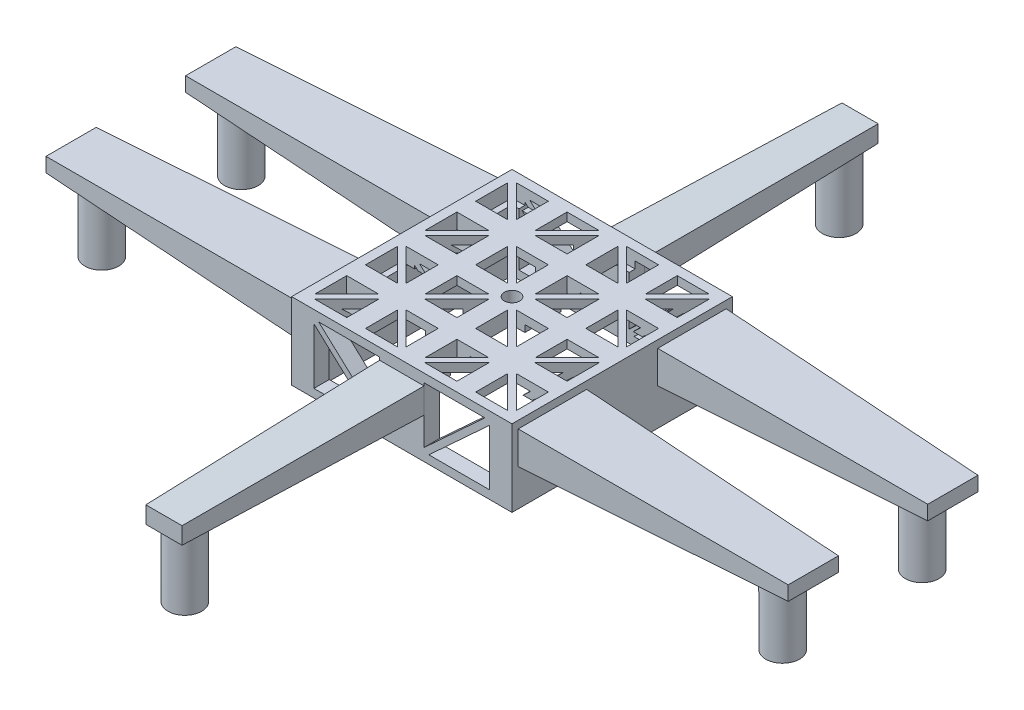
SolidWorks part; units mm, degrees
ref_plane "Front Plane" through (0, 0, 0) normal (0, 0, 1) x (1, 0, 0)
ref_plane "Top Plane" through (0, 0, 0) normal (0, 1, 0) x (1, 0, 0)
ref_plane "Right Plane" through (0, 0, 0) normal (1, 0, 0) x (0, 0, -1)
sketch "Sketch1" plane through (0, 0, 0) normal (0, 1, 0) x (1, 0, 0)
  line L1 (71.7881, -71.7881) -> (-71.7881, -71.7881)
  line L2 (71.7881, -71.7881) -> (71.7881, 71.7881)
  line L3 (71.7881, 71.7881) -> (-71.7881, 71.7881)
  line L4 (-71.7881, -71.7881) -> (-71.7881, 71.7881)
  line L5 (71.7881, -71.7881) -> (-71.7881, 71.7881) construction
  line L6 (71.7881, 71.7881) -> (-71.7881, -71.7881) construction
  point P0 (0, 0)
extrude "Boss-Extrude1" add sketch "Sketch1" along normal blind 50
sketch "Sketch2" plane through (0, 50, 0) normal (0, 1, 0) x (1, 0, 0)
  line L0 (-71.7881, 67.6803) -> (-67.6803, 67.6803) construction
  line L1 (-40.0018, 40.0018) -> (-67.6803, 40.0018) construction
  line L2 (-40.0018, 40.0018) -> (-40.0018, 67.6803) construction
  line L3 (0, 71.7881) -> (0, 0) construction
  line L4 (71.7881, 71.7881) -> (-71.7881, 71.7881) construction
  line L5 (-42.0018, 44.8303) -> (-62.8519, 65.6803)
  line L6 (-71.7881, 0) -> (71.7881, 0) construction
  line L7 (-71.7881, 71.7881) -> (-71.7881, -71.7881) construction
  line L8 (71.7881, -71.7881) -> (71.7881, 71.7881) construction
  line L9 (0, 35.894) -> (-71.7881, 35.894) construction
  line L10 (-35.894, 35.894) -> (-35.894, 71.7881) construction
  line L11 (-40.0018, 67.6803) -> (-67.6803, 67.6803) construction
  line L12 (-67.6803, 40.0018) -> (-67.6803, 67.6803) construction
  line L13 (-40.0018, 40.0018) -> (-67.6803, 67.6803) construction
  line L14 (-40.0018, 67.6803) -> (-67.6803, 40.0018) construction
  line L15 (-40.0018, 67.6803) -> (-35.894, 67.6803) construction
  line L16 (-42.0018, 65.6803) -> (-62.8519, 65.6803)
  line L17 (-42.0018, 44.8303) -> (-42.0018, 65.6803)
  line L18 (-65.6803, 42.0018) -> (-65.6803, 62.8519)
  line L19 (-44.8303, 42.0018) -> (-65.6803, 42.0018)
  line L20 (-44.8303, 42.0018) -> (-65.6803, 62.8519)
  line L21 (-29.7863, 44.8303) -> (-29.7863, 65.6803)
  line L22 (-29.7863, 65.6803) -> (-8.9362, 65.6803)
  line L23 (-29.7863, 44.8303) -> (-8.9362, 65.6803)
  line L24 (-26.9578, 42.0018) -> (-6.1078, 42.0018)
  line L25 (-6.1078, 42.0018) -> (-6.1078, 62.8519)
  line L26 (-26.9578, 42.0018) -> (-6.1078, 62.8519)
  line L27 (-26.9578, 29.7863) -> (-6.1078, 8.9362)
  line L28 (-6.1078, 29.7863) -> (-6.1078, 8.9362)
  line L29 (-26.9578, 29.7863) -> (-6.1078, 29.7863)
  line L30 (-29.7863, 26.9578) -> (-8.9362, 6.1078)
  line L31 (-29.7863, 6.1078) -> (-8.9362, 6.1078)
  line L32 (-29.7863, 26.9578) -> (-29.7863, 6.1078)
  line L33 (-42.0018, 26.9578) -> (-42.0018, 6.1078)
  line L34 (-42.0018, 6.1078) -> (-62.8519, 6.1078)
  line L35 (-42.0018, 26.9578) -> (-62.8519, 6.1078)
  line L36 (-65.6803, 29.7863) -> (-65.6803, 8.9362)
  line L37 (-44.8303, 29.7863) -> (-65.6803, 8.9362)
  line L38 (-44.8303, 29.7863) -> (-65.6803, 29.7863)
  line L39 (42.0018, 44.8303) -> (42.0018, 65.6803)
  line L40 (42.0018, 65.6803) -> (62.8519, 65.6803)
  line L41 (42.0018, 44.8303) -> (62.8519, 65.6803)
  line L42 (44.8303, 42.0018) -> (65.6803, 62.8519)
  line L43 (65.6803, 42.0018) -> (65.6803, 62.8519)
  line L44 (44.8303, 42.0018) -> (65.6803, 42.0018)
  line L45 (26.9578, 42.0018) -> (6.1078, 62.8519)
  line L46 (6.1078, 42.0018) -> (6.1078, 62.8519)
  line L47 (26.9578, 42.0018) -> (6.1078, 42.0018)
  line L48 (29.7863, 44.8303) -> (8.9362, 65.6803)
  line L49 (29.7863, 65.6803) -> (8.9362, 65.6803)
  line L50 (29.7863, 44.8303) -> (29.7863, 65.6803)
  line L51 (44.8303, 29.7863) -> (65.6803, 29.7863)
  line L52 (44.8303, 29.7863) -> (65.6803, 8.9362)
  line L53 (65.6803, 29.7863) -> (65.6803, 8.9362)
  line L54 (42.0018, 26.9578) -> (62.8519, 6.1078)
  line L55 (42.0018, 6.1078) -> (62.8519, 6.1078)
  line L56 (42.0018, 26.9578) -> (42.0018, 6.1078)
  line L57 (29.7863, 26.9578) -> (29.7863, 6.1078)
  line L58 (29.7863, 6.1078) -> (8.9362, 6.1078)
  line L59 (29.7863, 26.9578) -> (8.9362, 6.1078)
  line L60 (26.9578, 29.7863) -> (6.1078, 29.7863)
  line L61 (6.1078, 29.7863) -> (6.1078, 8.9362)
  line L62 (26.9578, 29.7863) -> (6.1078, 8.9362)
  line L63 (-40.0018, -67.6803) -> (-35.894, -67.6803) construction
  line L64 (-40.0018, -67.6803) -> (-67.6803, -40.0018) construction
  line L65 (-40.0018, -40.0018) -> (-67.6803, -67.6803) construction
  line L66 (-67.6803, -40.0018) -> (-67.6803, -67.6803) construction
  line L67 (-40.0018, -67.6803) -> (-67.6803, -67.6803) construction
  line L68 (-40.0018, -40.0018) -> (-40.0018, -67.6803) construction
  line L69 (-40.0018, -40.0018) -> (-67.6803, -40.0018) construction
  line L70 (-71.7881, -67.6803) -> (-67.6803, -67.6803) construction
  line L71 (-44.8303, -42.0018) -> (-65.6803, -62.8519)
  line L72 (-44.8303, -42.0018) -> (-65.6803, -42.0018)
  line L73 (-65.6803, -42.0018) -> (-65.6803, -62.8519)
  line L74 (-42.0018, -44.8303) -> (-42.0018, -65.6803)
  line L75 (-42.0018, -65.6803) -> (-62.8519, -65.6803)
  line L76 (-42.0018, -44.8303) -> (-62.8519, -65.6803)
  line L77 (-26.9578, -42.0018) -> (-6.1078, -62.8519)
  line L78 (-6.1078, -42.0018) -> (-6.1078, -62.8519)
  line L79 (-26.9578, -42.0018) -> (-6.1078, -42.0018)
  line L80 (-29.7863, -44.8303) -> (-8.9362, -65.6803)
  line L81 (-29.7863, -65.6803) -> (-8.9362, -65.6803)
  line L82 (-29.7863, -44.8303) -> (-29.7863, -65.6803)
  line L83 (-44.8303, -29.7863) -> (-65.6803, -29.7863)
  line L84 (-44.8303, -29.7863) -> (-65.6803, -8.9362)
  line L85 (-65.6803, -29.7863) -> (-65.6803, -8.9362)
  line L86 (-42.0018, -26.9578) -> (-62.8519, -6.1078)
  line L87 (-42.0018, -6.1078) -> (-62.8519, -6.1078)
  line L88 (-42.0018, -26.9578) -> (-42.0018, -6.1078)
  line L89 (-29.7863, -26.9578) -> (-29.7863, -6.1078)
  line L90 (-29.7863, -6.1078) -> (-8.9362, -6.1078)
  line L91 (-29.7863, -26.9578) -> (-8.9362, -6.1078)
  line L92 (-26.9578, -29.7863) -> (-6.1078, -29.7863)
  line L93 (-6.1078, -29.7863) -> (-6.1078, -8.9362)
  line L94 (-26.9578, -29.7863) -> (-6.1078, -8.9362)
  line L95 (26.9578, -29.7863) -> (6.1078, -8.9362)
  line L96 (6.1078, -29.7863) -> (6.1078, -8.9362)
  line L97 (26.9578, -29.7863) -> (6.1078, -29.7863)
  line L98 (29.7863, -26.9578) -> (8.9362, -6.1078)
  line L99 (29.7863, -6.1078) -> (8.9362, -6.1078)
  line L100 (29.7863, -26.9578) -> (29.7863, -6.1078)
  line L101 (42.0018, -26.9578) -> (42.0018, -6.1078)
  line L102 (42.0018, -6.1078) -> (62.8519, -6.1078)
  line L103 (42.0018, -26.9578) -> (62.8519, -6.1078)
  line L104 (65.6803, -29.7863) -> (65.6803, -8.9362)
  line L105 (44.8303, -29.7863) -> (65.6803, -8.9362)
  line L106 (44.8303, -29.7863) -> (65.6803, -29.7863)
  line L107 (29.7863, -44.8303) -> (29.7863, -65.6803)
  line L108 (29.7863, -65.6803) -> (8.9362, -65.6803)
  line L109 (29.7863, -44.8303) -> (8.9362, -65.6803)
  line L110 (26.9578, -42.0018) -> (6.1078, -42.0018)
  line L111 (6.1078, -42.0018) -> (6.1078, -62.8519)
  line L112 (26.9578, -42.0018) -> (6.1078, -62.8519)
  line L113 (44.8303, -42.0018) -> (65.6803, -42.0018)
  line L114 (65.6803, -42.0018) -> (65.6803, -62.8519)
  line L115 (44.8303, -42.0018) -> (65.6803, -62.8519)
  line L116 (42.0018, -44.8303) -> (62.8519, -65.6803)
  line L117 (42.0018, -65.6803) -> (62.8519, -65.6803)
  line L118 (42.0018, -44.8303) -> (42.0018, -65.6803)
  point P0 (-53.8411, 53.8411)
  point P20 (-35.894, 53.8411)
  point P79 (-53.8411, -53.8411)
  dimension "D1" = 2
extrude "Cut-Extrude1" cut sketch "Sketch2" against normal blind 10
sketch "Sketch3" plane through (0, 0, 0) normal (0, -1, 0) x (1, 0, 0)
  line L8 (-61.7881, 61.7881) -> (-61.7881, -61.7881)
  line L9 (-61.7881, -61.7881) -> (61.7881, -61.7881)
  line L10 (61.7881, -61.7881) -> (61.7881, 61.7881)
  line L11 (61.7881, 61.7881) -> (-61.7881, 61.7881)
  line L12 (-61.7881, 61.7881) -> (-61.7881, -61.7881)
  line L13 (-61.7881, -61.7881) -> (61.7881, -61.7881)
  line L14 (61.7881, -61.7881) -> (61.7881, 61.7881)
  line L15 (61.7881, 61.7881) -> (-61.7881, 61.7881)
  dimension "D1" = 10
extrude "Cut-Extrude2" cut sketch "Sketch3" against normal offset from surface (40 mm away) 10
sketch "Sketch4" plane through (0, 0, -71.7881) normal (0, 0, -1) x (-1, 0, 0)
  line L0 (0, 0) -> (0, 50) construction
  line L1 (-71.7881, 50) -> (71.7881, 50) construction
  line L2 (0, 0) -> (-71.7881, 0) construction
  line L3 (-12.5006, 3.4579) -> (-59.2875, 3.4579) construction
  line L4 (-12.5006, 3.4579) -> (-12.5006, 46.5421) construction
  line L5 (-12.5006, 46.5421) -> (-59.2875, 46.5421) construction
  line L6 (-59.2875, 3.4579) -> (-59.2875, 46.5421) construction
  line L7 (-12.5006, 3.4579) -> (-59.2875, 46.5421) construction
  line L8 (-12.5006, 46.5421) -> (-59.2875, 3.4579) construction
  line L9 (-14.5006, 8.0184) -> (-54.1631, 44.5421)
  line L10 (-14.5006, 44.5421) -> (-54.1631, 44.5421)
  line L11 (-14.5006, 8.0184) -> (-14.5006, 44.5421)
  line L12 (-17.625, 5.4579) -> (-57.2875, 41.9816)
  line L13 (-57.2875, 5.4579) -> (-57.2875, 41.9816)
  line L14 (-17.625, 5.4579) -> (-57.2875, 5.4579)
  line L15 (14.5006, 8.0184) -> (14.5006, 44.5421)
  line L16 (14.5006, 44.5421) -> (54.1631, 44.5421)
  line L17 (14.5006, 8.0184) -> (54.1631, 44.5421)
  line L18 (17.625, 5.4579) -> (57.2875, 5.4579)
  line L19 (57.2875, 5.4579) -> (57.2875, 41.9816)
  line L20 (17.625, 5.4579) -> (57.2875, 41.9816)
  point P5 (-35.894, 25)
  point P10 (-12.5006, 25)
  point P11 (0, 25)
  point P12 (-35.894, 0)
  dimension "D1" = 2
  dimension "D2" = 2
extrude "Cut-Extrude3" cut sketch "Sketch4" against normal through all
sketch "Sketch5" plane through (0, 50, 0) normal (0, 1, 0) x (1, 0, 0)
  circle A0 centre (0, 0) radius 5
  dimension "D1" = 10
extrude "Cut-Extrude4" cut sketch "Sketch5" against normal through all
sketch "Sketch6" plane through (71.7881, 0, 0) normal (1, 0, 0) x (0, 0, -1)
  line L1 (-23.156, 23.8928) -> (-67.7739, 23.8928)
  line L2 (-23.156, 23.8928) -> (-23.156, 45.1283)
  line L3 (-23.156, 45.1283) -> (-67.7739, 45.1283)
  line L4 (-67.7739, 23.8928) -> (-67.7739, 45.1283)
  line L5 (-23.156, 23.8928) -> (-67.7739, 45.1283) construction
  line L6 (-23.156, 45.1283) -> (-67.7739, 23.8928) construction
  point P0 (-45.465, 34.5106)
  point P5 (-36.3731, 15.866)
  point P6 (-8.2382, 34.2186)
  point P7 (-30.8147, 16.5429)
  point P8 (-31.6702, 30.775)
  point P9 (-45.465, 34.5106)
extrude "Boss-Extrude2" add sketch "Sketch6" along normal blind 170 draft 2
ref_plane "Plane1" through (0, 34.5106, 0) normal (0, 1, 0) x (1, 0, 0)
sketch "Sketch7" plane through (0, 34.5106, 0) normal (0, 1, 0) x (1, 0, 0)
  line L0 (241.7881, -29.0926) -> (241.7881, -61.8373) construction
  line L1 (241.7881, -61.8373) -> (241.7881, -29.0926) construction
  circle A0 centre (221.7881, -45.465) radius 9
  circle A1 centre (221.7881, -45.465) radius 11
  point P6 (241.7881, -45.465)
  dimension "D2" = 22
  dimension "D3" = 20
  dimension "D1" = 2
extrude "Boss-Extrude3" add sketch "Sketch7" against normal blind 50
sketch "Sketch8" plane through (0, 34.5106, 0) normal (0, 1, 0) x (1, 0, 0)
  circle A0 centre (221.7881, -45.465) radius 9 construction
  circle A1 centre (221.7881, -45.465) radius 9
extrude "Cut-Extrude5" cut sketch "Sketch8" against normal blind 50
mirror "Mirror2" about plane through (0, 0, 0) normal (0, 0, 1) of "Boss-Extrude2", "Boss-Extrude3"
mirror "Mirror3" about plane through (0, 0, 0) normal (1, 0, 0) of "Mirror2", "Boss-Extrude2", "Boss-Extrude3"
sketch "Sketch9" plane through (0, 0, -71.7881) normal (0, 0, -1) x (-1, 0, 0)
  line L0 (71.7881, 45.1283) -> (71.7881, 23.8928) construction
  line L1 (14.5006, 26.2803) -> (-14.5006, 26.2803)
  line L2 (14.5006, 26.2803) -> (14.5006, 42.7409)
  line L3 (14.5006, 42.7409) -> (-14.5006, 42.7409)
  line L4 (-14.5006, 26.2803) -> (-14.5006, 42.7409)
  line L5 (14.5006, 26.2803) -> (-14.5006, 42.7409) construction
  line L6 (14.5006, 42.7409) -> (-14.5006, 26.2803) construction
  line L7 (-14.5006, 8.0184) -> (-14.5006, 44.5421) construction
  line L8 (14.5006, 44.5421) -> (14.5006, 8.0184) construction
  point P0 (0, 34.5106)
  point P7 (71.7881, 34.5106)
  point P8 (-14.5006, 26.2803)
  point P11 (14.5006, 26.2803)
extrude "Boss-Extrude4" add sketch "Sketch9" along normal blind 155 draft 1
sketch "Sketch10" plane through (0, 34.5106, 0) normal (0, 1, 0) x (1, 0, 0)
  circle A0 centre (0, 213.1654) radius 9
  circle A1 centre (0, 213.1654) radius 11
  dimension "D1" = 18
  dimension "D2" = 2
extrude "Boss-Extrude5" add sketch "Sketch10" against normal blind 50
sketch "Sketch11" plane through (0, 34.5106, 0) normal (0, 1, 0) x (1, 0, 0)
  circle A0 centre (0, 213.1654) radius 9 construction
  circle A1 centre (0, 213.1654) radius 9
extrude "Cut-Extrude6" cut sketch "Sketch11" against normal blind 50
mirror "Mirror4" about plane through (0, 0, 0) normal (0, 0, 1) of "Boss-Extrude5", "Boss-Extrude4"
